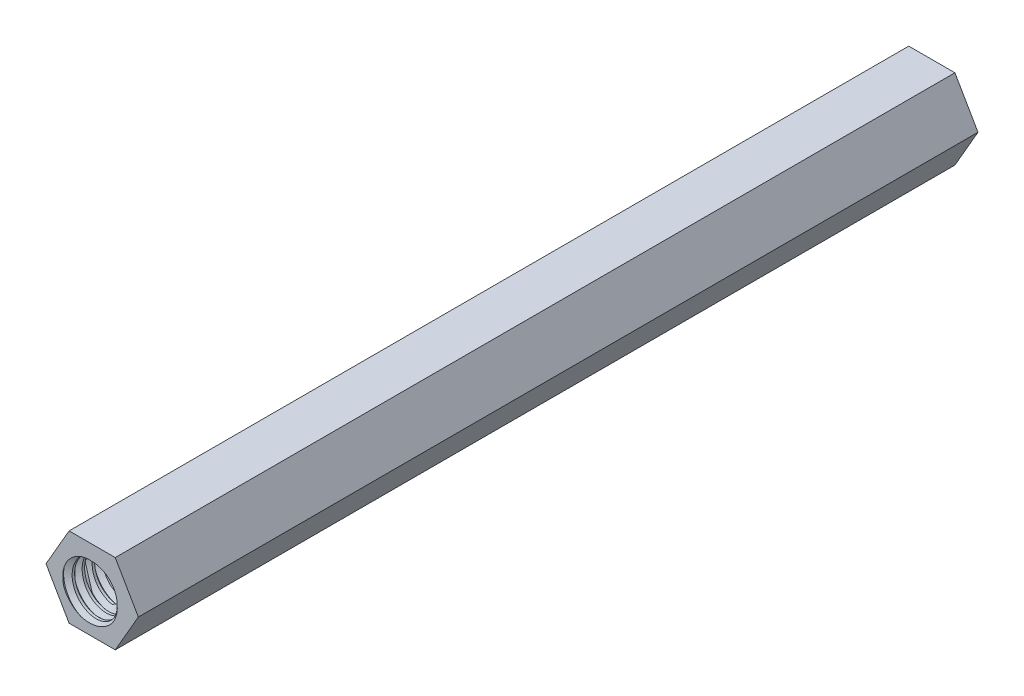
SolidWorks part; units mm, degrees
ref_plane "Front Plane" through (0, 0, 0) normal (0, 0, 1) x (1, 0, 0)
ref_plane "Top Plane" through (0, 0, 0) normal (0, 1, 0) x (1, 0, 0)
ref_plane "Right Plane" through (0, 0, 0) normal (1, 0, 0) x (0, 0, -1)
sketch "Sketch1" plane through (0, 0, 0) normal (0, 0, 1) x (1, 0, 0)
  line L1 (2.3094, 0) -> (1.1547, 2)
  line L2 (1.1547, 2) -> (-1.1547, 2)
  line L3 (-1.1547, 2) -> (-2.3094, 0)
  line L4 (-2.3094, 0) -> (-1.1547, -2)
  line L5 (-1.1547, -2) -> (1.1547, -2)
  line L6 (1.1547, -2) -> (2.3094, 0)
  circle A0 centre (0, 0) radius 2 construction
  dimension "D1" = 4
extrude "Boss-Extrude1" add sketch "Sketch1" against normal blind 42
sketch "Sketch2" plane through (0, 0, 0) normal (0, 0, 1) x (1, 0, 0)
  circle A0 centre (0, 0) radius 1.25
  dimension "D1" = 2.5
extrude "Cut-Extrude1" cut sketch "Sketch2" along normal through all and the other way through all
thread "Thread_M3x0.5_Internal_Through_RH" pitch 0.5 start angle 0, offset 0, length 0, pitch 0.5, diameter 2.5
ref_plane "Plane1" through (1.25, 0, -42) normal (0, -1, 0) x (1, 0, 0)
sketch "Thread Profile1" plane through (1.25, 0, -42) normal (0, -1, 0) x (1, 0, 0)
  line L0 (0, 0) -> (0, 0.5) construction
  line L1 (0, 0) -> (0.2706, 0.1562)
  line L2 (0.2706, 0.1562) -> (0.2706, 0.2187)
  line L3 (0.2706, 0.2187) -> (0, 0.375)
  line L4 (0.2706, 0.1875) -> (0, 0.1875) construction
  line L11 (0, 0) -> (0, 0.375)
  point P2 (0, 0)
  dimension "Pitch" = 0.5
  dimension "Profile_Angle" = 60
  dimension "Profile_Land" = 0.0625
  dimension "Profile_Height" = 0.2706
